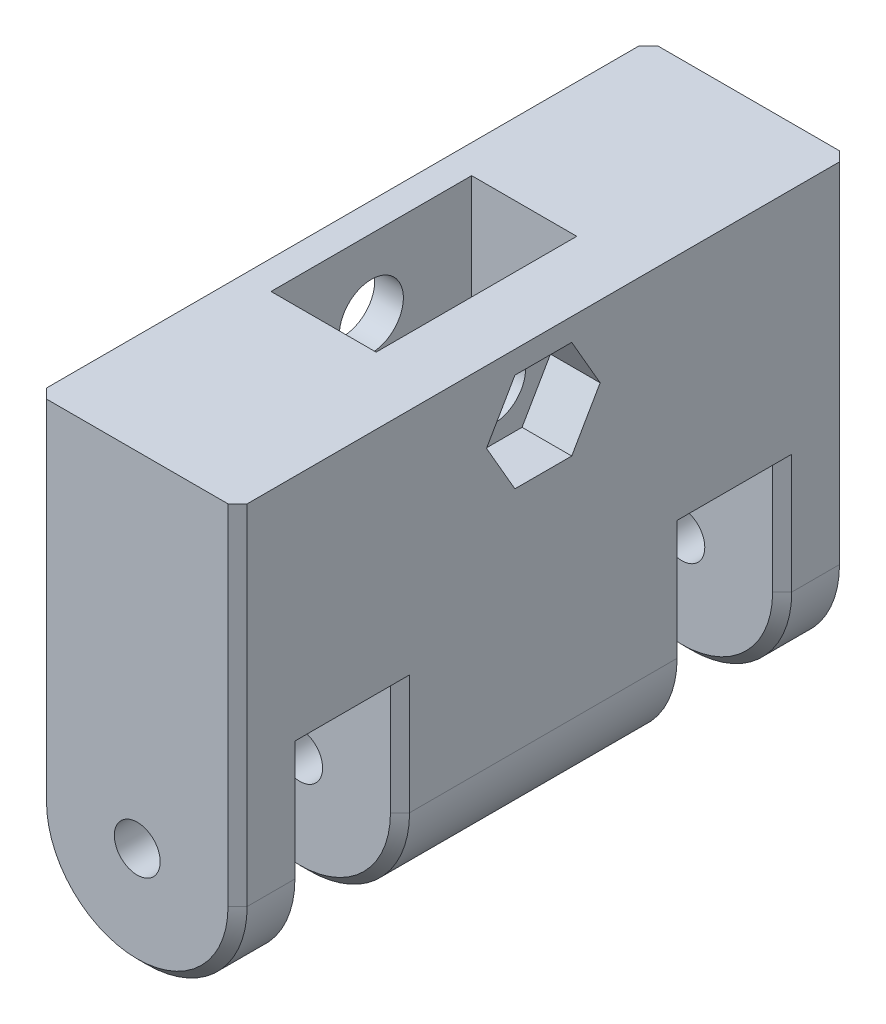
SolidWorks part; units mm, degrees
ref_plane "Front Plane" through (0, 0, 0) normal (0, 0, 1) x (1, 0, 0)
ref_plane "Top Plane" through (0, 0, 0) normal (0, 1, 0) x (1, 0, 0)
ref_plane "Right Plane" through (0, 0, 0) normal (1, 0, 0) x (0, 0, -1)
sketch "Sketch2" plane through (0, 0, 0) normal (0, 0, 1) x (1, 0, 0)
  line L1 (-21, 25) -> (0, 25)
  line L2 (-21, 25) -> (-21, 0)
  line L3 (-21, 0) -> (0, 0)
  line L4 (0, 25) -> (0, 0)
  dimension "D1" = 25
  dimension "D2" = 21
extrude "Boss-Extrude1" add sketch "Sketch2" along normal mid plane 64
sketch "Sketch3" plane through (0, 25, 0) normal (0, 1, 0) x (1, 0, 0)
  line L1 (-18, 10.5) -> (-7, 10.5)
  line L2 (-18, 10.5) -> (-18, -10.5)
  line L3 (-18, -10.5) -> (-7, -10.5)
  line L4 (-7, 10.5) -> (-7, -10.5)
  point P4 (-7, 0)
  dimension "D1" = 11
  dimension "D2" = 21
  dimension "D3" = 7
extrude "Cut-Extrude1" cut sketch "Sketch3" against normal blind 18.5
sketch "Sketch4" plane through (-21, 0, 0) normal (-1, 0, 0) x (0, 0, 1)
  line L0 (32, 25) -> (-32, 25) construction
  circle A0 centre (0, 17.5) radius 3.35
  point P5 (0, 25)
  dimension "D2" = 6.7
  dimension "D1" = 7.5
extrude "Cut-Extrude2" cut sketch "Sketch4" against normal through all both and the other way through all
sketch "Sketch5" plane through (0, 0, 0) normal (1, 0, 0) x (0, 0, -1)
  line L1 (2.9734, 22.65) -> (-2.9734, 22.65)
  line L2 (-2.9734, 22.65) -> (-5.9467, 17.5)
  line L3 (-5.9467, 17.5) -> (-2.9734, 12.35)
  line L4 (-2.9734, 12.35) -> (2.9734, 12.35)
  line L5 (2.9734, 12.35) -> (5.9467, 17.5)
  line L6 (5.9467, 17.5) -> (2.9734, 22.65)
  circle A0 centre (0, 17.5) radius 5.15 construction
  dimension "D1" = 10.3
extrude "Cut-Extrude3" cut sketch "Sketch5" against normal blind 5.2
sketch "Sketch6" plane through (0, 0, 0) normal (0, -1, 0) x (1, 0, 0)
  line L0 (-21, 32) -> (-21, -32) construction
  line L5 (-21, 15) -> (0, 15)
  line L10 (-21, 15) -> (-21, -15)
  line L11 (0, 32) -> (0, -32) construction
  line L12 (-21, 32) -> (0, 32)
  line L13 (-21, 32) -> (-21, 25)
  line L14 (-21, 25) -> (0, 25)
  line L15 (0, 32) -> (0, 25)
  line L25 (11.55, 0) -> (-11.55, 0) construction
  line L30 (-21, -25) -> (0, -25)
  line L31 (0, -32) -> (0, -25)
  line L32 (-21, -32) -> (0, -32)
  line L33 (-21, -32) -> (-21, -25)
  line L34 (-21, -15) -> (0, -15)
  line L35 (0, 15) -> (0, -15)
  point P14 (0, 0)
  dimension "D1" = 10
  dimension "D2" = 7
extrude "Boss-Extrude2" add sketch "Sketch6" along normal blind 22
sketch "Sketch7" plane through (0, 0, -25) normal (0, 0, 1) x (1, 0, 0)
  line L0 (0, -22) -> (0, 0) construction
  line L1 (0, 0) -> (-21, 0) construction
  circle A0 centre (-10.5, -11) radius 2.4
  point P4 (0, -11)
  point P7 (-10.5, 0)
  dimension "D1" = 4.8
extrude "Cut-Extrude4" cut sketch "Sketch7" against normal through all both and the other way through all
fillet "Fillet1" radius 10.5 6 edges at (0, -22, -28.5) (-21, -22, -28.5) (-21, -22, 28.5) (0, -22, 28.5) (0, -22, 0) (-21, -22, 0)
chamfer "Chamfer1" distance 1 angle 45 28 edges at (-21, -5.75, -25) (-17.9246, -18.9246, -25) (-3.0754, -18.9246, -25) (0, -5.75, -25) (0, 0, -20) (0, 0, 20) (0, -5.75, -15) (-3.0754, -18.9246, -15) (-17.9246, -18.9246, -15) (-21, 0, -20) (-21, -5.75, -15) (0, -5.75, 15) (0, -5.75, 25) (-3.0754, -18.9246, 15) (-3.0754, -18.9246, 25) (-17.9246, -18.9246, 15) (-17.9246, -18.9246, 25) (-21, -5.75, 15) (-21, 0, 20) (-21, -5.75, 25) (0, 6.75, -32) (-3.0754, -18.9246, -32) (-17.9246, -18.9246, -32) (-21, 6.75, -32) (0, 6.75, 32) (-3.0754, -18.9246, 32) (-17.9246, -18.9246, 32) (-21, 6.75, 32)
